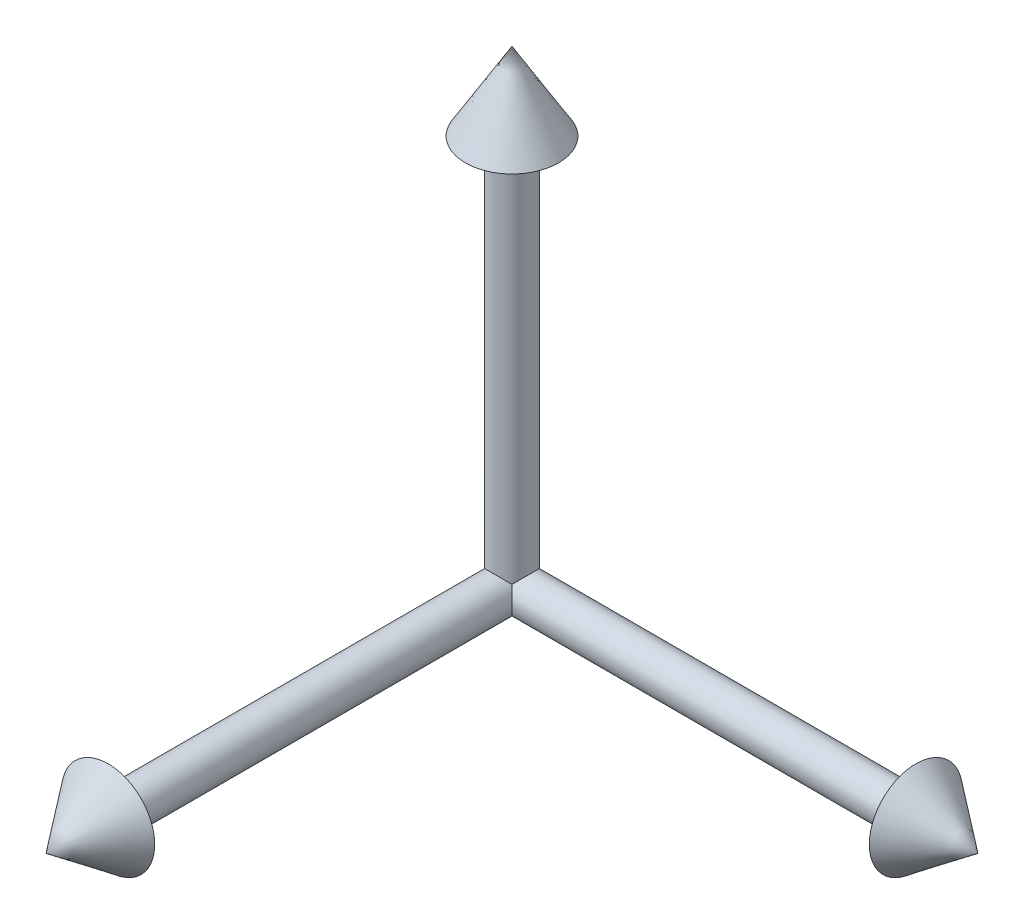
SolidWorks part; units mm, degrees
ref_plane "Front Plane" through (0, 0, 0) normal (0, 0, 1) x (1, 0, 0)
ref_plane "Top Plane" through (0, 0, 0) normal (0, 1, 0) x (1, 0, 0)
ref_plane "Right Plane" through (0, 0, 0) normal (1, 0, 0) x (0, 0, -1)
sketch "Sketch1" plane through (0, 0, 0) normal (0, 0, 1) x (1, 0, 0)
  line L0 (3.175, 0) -> (3.175, 63.5)
  line L1 (3.175, 63.5) -> (7.62, 63.5)
  line L2 (7.62, 63.5) -> (0, 76.2)
  line L3 (0, 105.2613) -> (0, -26.773) construction
  line L4 (3.175, 0) -> (0, 0)
  line L5 (0, 76.2) -> (0, 0)
  dimension "D1" = 76.2
  dimension "D2" = 6.35
  dimension "D3" = 12.7
  dimension "D4" = 15.24
revolve "Revolve1" add sketch "Sketch1" angle 360 about L3
sketch "Sketch3" plane through (0, 0, 0) normal (1, 0, 0) x (0, 0, -1)
  line L0 (0, 0) -> (-76.2, 0) construction
  line L1 (0, 3.175) -> (-66.04, 3.175)
  line L2 (-66.04, 3.175) -> (-66.04, 7.62)
  line L3 (-66.04, 7.62) -> (-76.2, 0)
  line L4 (0, 3.175) -> (0, 0)
  line L5 (0, 0) -> (-76.2, 0)
  dimension "D1" = 76.2
  dimension "D2" = 6.35
  dimension "D3" = 15.24
  dimension "D4" = 10.16
revolve "Revolve2" add sketch "Sketch3" angle 360 about L0
sketch "Sketch4" plane through (0, 0, 0) normal (0, 0, 1) x (1, 0, 0)
  line L0 (0, 0) -> (70.0064, 0) construction
  line L1 (0, 3.175) -> (66.04, 3.175)
  line L2 (66.04, 3.175) -> (66.04, 7.62)
  line L3 (66.04, 7.62) -> (76.2, 0)
  line L4 (0, 3.175) -> (0, 0)
  line L5 (0, 0) -> (76.2, 0)
  dimension "D1" = 76.2
  dimension "D2" = 6.35
  dimension "D3" = 15.24
  dimension "D4" = 10.16
revolve "Revolve3" add sketch "Sketch4" angle 360 about L0
